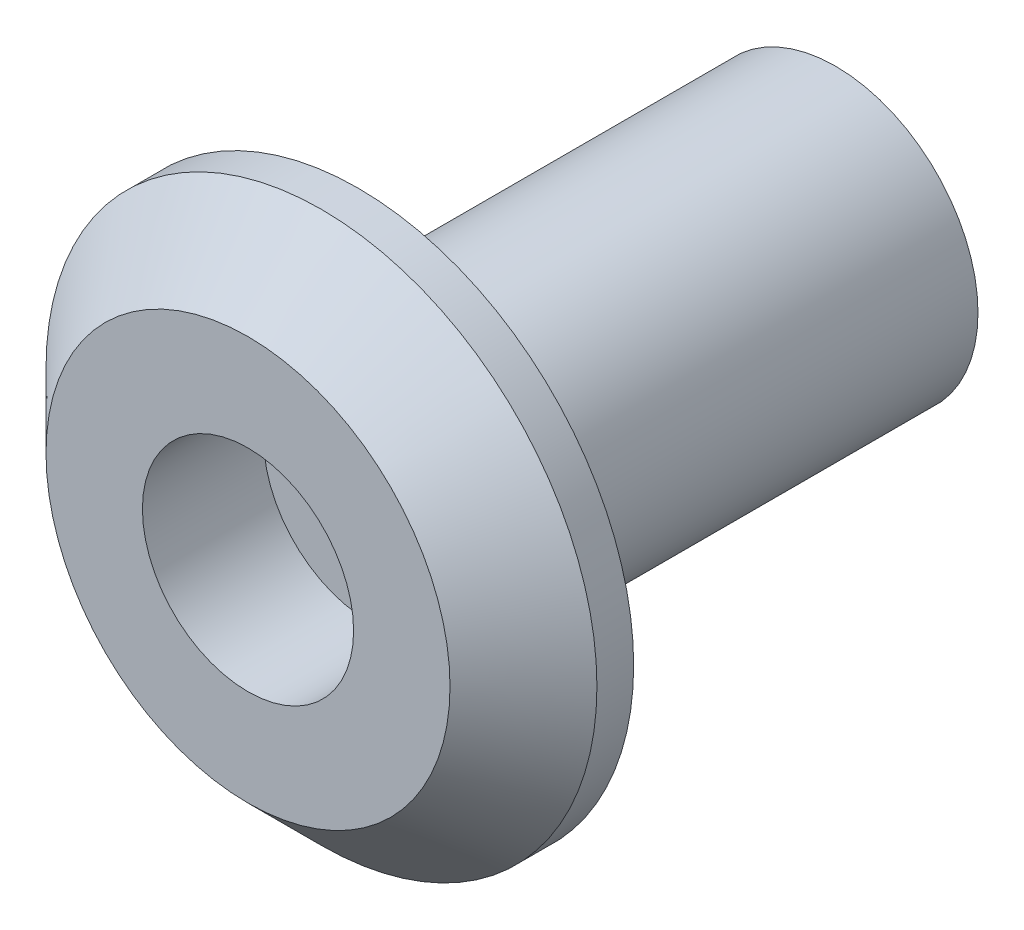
SolidWorks part; units mm, degrees
ref_plane "Alzado" through (0, 0, 0) normal (0, 0, 1) x (1, 0, 0)
ref_plane "Planta" through (0, 0, 0) normal (0, 1, 0) x (1, 0, 0)
ref_plane "Vista lateral" through (0, 0, 0) normal (1, 0, 0) x (0, 0, -1)
sketch "Croquis1" plane through (0, 0, 0) normal (0, 0, 1) x (1, 0, 0)
  circle A0 centre (0, 0) radius 7.5
  circle A1 centre (0, 0) radius 1.55
  dimension "D1" = 15
  dimension "D2" = 3.1
extrude "Saliente-Extruir1" add sketch "Croquis1" along normal mid plane 3
chamfer "Chaflán1" distance 2 angle 45 1 edges at (7.5, 0, 1.5)
sketch "Croquis2" plane through (0, 0, -1.5) normal (0, 0, -1) x (-1, 0, 0)
  circle A2 centre (0, 0) radius 1.55 construction
  circle A3 centre (0, 0) radius 1.55
  circle A4 centre (0, 0) radius 3.875
  dimension "D1" = 7.75
extrude "Saliente-Extruir2" add sketch "Croquis2" along normal blind 13
sketch "Croquis3" plane through (0, 0, 1.5) normal (0, 0, 1) x (1, 0, 0)
  circle A0 centre (0, 0) radius 2.875
  dimension "D1" = 5.75
extrude "Cortar-Extruir1" cut sketch "Croquis3" against normal blind 3.3
